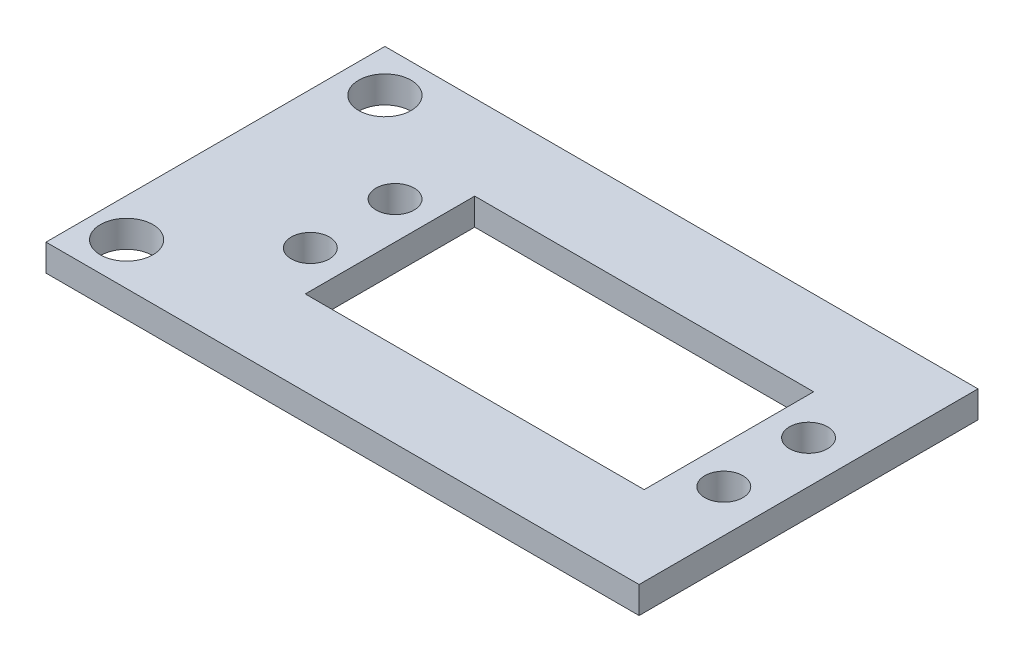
SolidWorks part; units mm, degrees
ref_plane "Front Plane" through (0, 0, 0) normal (0, 0, 1) x (1, 0, 0)
ref_plane "Top Plane" through (0, 0, 0) normal (0, 1, 0) x (1, 0, 0)
ref_plane "Right Plane" through (0, 0, 0) normal (1, 0, 0) x (0, 0, -1)
sketch "Sketch1" plane through (0, 0, 0) normal (0, 1, 0) x (1, 0, 0)
  line L1 (35, -20) -> (-35, -20)
  line L2 (35, -20) -> (35, 20)
  line L3 (35, 20) -> (-35, 20)
  line L4 (-35, -20) -> (-35, 20)
  line L5 (35, -20) -> (-35, 20) construction
  line L6 (35, 20) -> (-35, -20) construction
  line L11 (30, -5) -> (-18.8, -5) construction
  line L12 (30, -5) -> (30, 5) construction
  line L13 (30, 5) -> (-18.8, 5) construction
  line L14 (-18.8, -5) -> (-18.8, 5) construction
  line L15 (30, -5) -> (-18.8, 5) construction
  line L16 (30, 5) -> (-18.8, -5) construction
  line L17 (25.6, -10) -> (-14.4, -10)
  line L18 (25.6, -10) -> (25.6, 10)
  line L19 (25.6, 10) -> (-14.4, 10)
  line L20 (-14.4, -10) -> (-14.4, 10)
  line L21 (25.6, -10) -> (-14.4, 10) construction
  line L22 (25.6, 10) -> (-14.4, -10) construction
  circle A0 centre (30, 5) radius 2.25
  circle A1 centre (-18.8, 5) radius 2.25
  circle A2 centre (-18.8, -5) radius 2.25
  circle A3 centre (30, -5) radius 2.25
  circle A4 centre (-30, 15) radius 3.1
  circle A5 centre (-30.4867, -15) radius 3.1
  point P0 (0, 0)
  point P6 (0, 0)
  point P7 (5.6, 0)
  point P16 (30, 0)
  point P17 (5.6, 0)
  dimension "D5" = 4.5
  dimension "D12" = 6.2
  dimension "D1" = 70
  dimension "D2" = 40
  dimension "D3" = 48.8
  dimension "D4" = 10
  dimension "D6" = 5
  dimension "D7" = 20
  dimension "D8" = 40
  dimension "D9" = 5
  dimension "D10" = 5
  dimension "D11" = 5
extrude "Boss-Extrude1" add sketch "Sketch1" along normal blind 3.175
